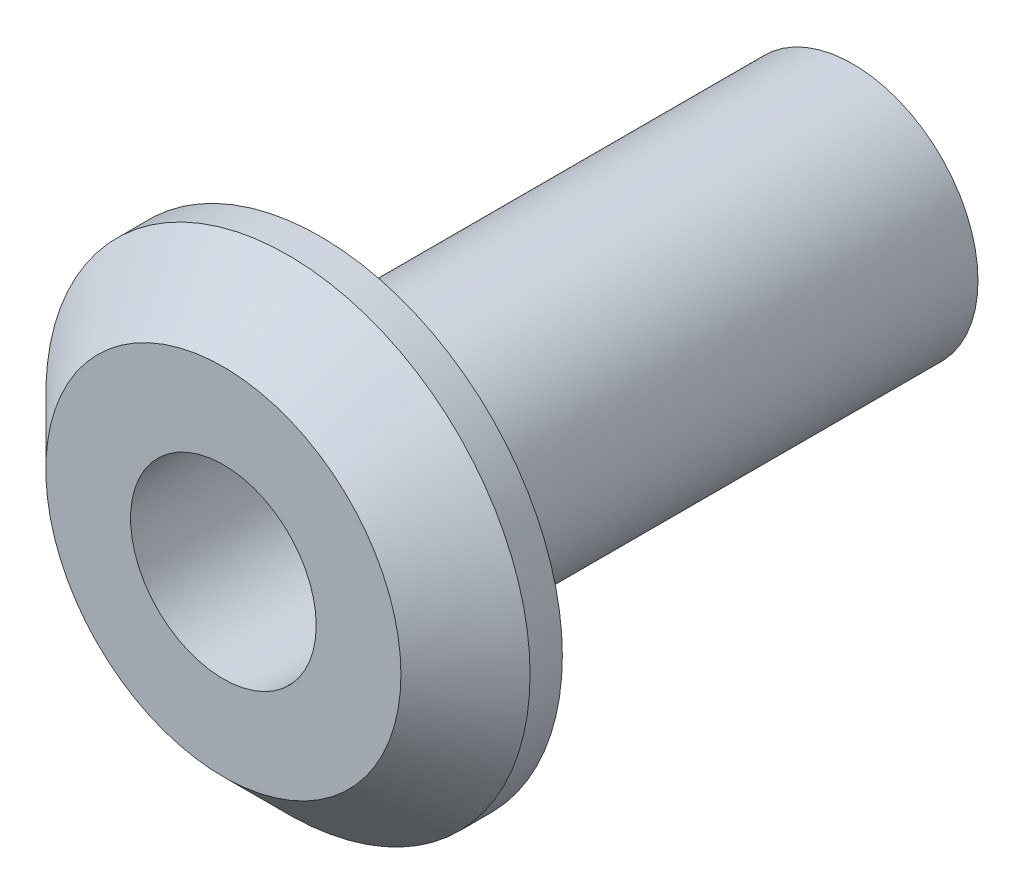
SolidWorks part; units mm, degrees
ref_plane "Alzado" through (0, 0, 0) normal (0, 0, 1) x (1, 0, 0)
ref_plane "Planta" through (0, 0, 0) normal (0, 1, 0) x (1, 0, 0)
ref_plane "Vista lateral" through (0, 0, 0) normal (1, 0, 0) x (0, 0, -1)
sketch "Croquis1" plane through (0, 0, 0) normal (0, 0, 1) x (1, 0, 0)
  circle A0 centre (0, 0) radius 7.5
  circle A1 centre (0, 0) radius 1.55
  dimension "D1" = 15
  dimension "D2" = 3.1
extrude "Saliente-Extruir1" add sketch "Croquis1" along normal mid plane 3
chamfer "Chaflán1" distance 2 angle 45 1 edges at (7.5, 0, 1.5)
sketch "Croquis2" plane through (0, 0, -1.5) normal (0, 0, -1) x (-1, 0, 0)
  circle A2 centre (0, 0) radius 1.55 construction
  circle A3 centre (0, 0) radius 1.55
  circle A4 centre (0, 0) radius 3.875
  dimension "D1" = 7.75
extrude "Saliente-Extruir2" add sketch "Croquis2" along normal blind 16.5
sketch "Croquis3" plane through (0, 0, 1.5) normal (0, 0, 1) x (1, 0, 0)
  circle A0 centre (0, 0) radius 2.875
  dimension "D1" = 5.75
extrude "Cortar-Extruir1" cut sketch "Croquis3" against normal blind 7.5
